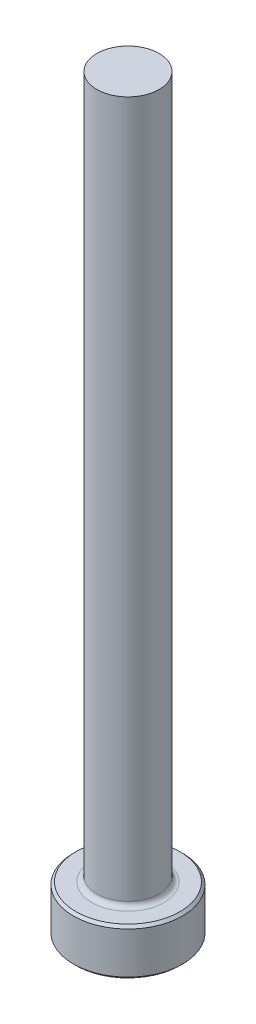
SolidWorks part; units mm, degrees
ref_plane "Front Plane" through (0, 0, 0) normal (0, 0, 1) x (1, 0, 0)
ref_plane "Top Plane" through (0, 0, 0) normal (0, 1, 0) x (1, 0, 0)
ref_plane "Right Plane" through (0, 0, 0) normal (1, 0, 0) x (0, 0, -1)
sketch "Sketch1" plane through (0, 0, 0) normal (0, 0, 1) x (1, 0, 0)
  line L0 (0, 259.9588) -> (0, -15.1925) construction
  line L1 (0, 0) -> (-5.5499, 0)
  line L2 (-5.5499, 0) -> (-5.5499, 4.7498)
  line L3 (-5.5499, 4.7498) -> (-3.175, 4.7498)
  line L4 (-3.175, 4.7498) -> (-3.175, 76.2)
  line L5 (-3.175, 76.2) -> (0, 76.2)
  line L6 (0, 76.2) -> (0, 0)
  dimension "L" = 76.2
  dimension "H" = 11.0998
  dimension "T" = 4.7498
  dimension "D" = 6.35
revolve "Revolve1" add sketch "Sketch1" angle 360 about L0
chamfer "Chamfer1" distance 0.254 angle 45 2 edges at (0, 4.7498, 5.5499) (0, 0, 5.5499)
fillet "Fillet1" radius 0.508 1 edges at (0, 4.7498, 3.175)
sketch "Pocket Sketch" plane through (0, 0, 0) normal (0, 0, 1) x (1, 0, 0)
  line L0 (-5.9468, 0) -> (-5.9468, 4.7752)
  line L1 (-5.9468, 4.7752) -> (-4.3339, 4.7752)
  line L2 (-3.5719, 5.5372) -> (-3.5719, 22.225)
  line L3 (-3.5719, 22.225) -> (0, 22.225)
  line L4 (0, 22.225) -> (0, 0)
  line L5 (0, 0) -> (-5.9468, 0)
  line L6 (0, 12.6104) -> (0, -2.4989) construction
  line L7 (-5.5499, 4.4958) -> (-5.5499, 0.254) construction
  line L8 (5.2959, 4.7498) -> (-5.2959, 4.7498) construction
  line L9 (-3.175, 76.2) -> (-3.175, 5.2578) construction
  line L10 (-4.3339, 4.7752) -> (-3.5719, 5.5372)
  point P3 (-3.5719, 4.7752)
  dimension "D1" = 11.8935
  dimension "D2" = 0.3969
  dimension "D3" = 0.0254
  dimension "D4" = 0.3969
  dimension "D5" = 7.1437
  dimension "D6" = 22.225
